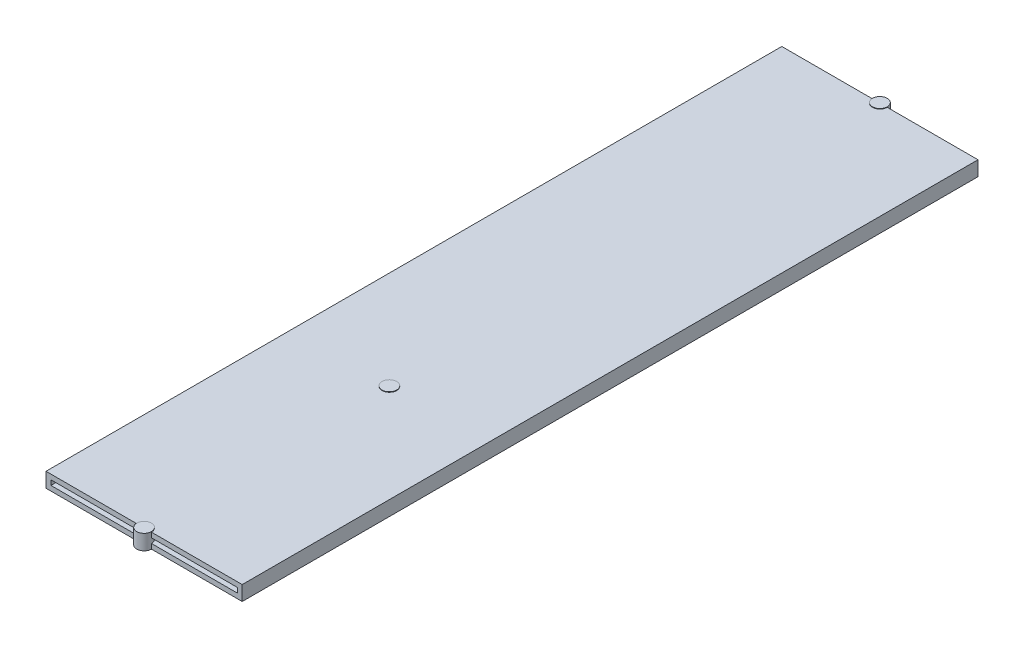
SolidWorks part; units mm, degrees
ref_plane "Plan de face" through (0, 0, 0) normal (0, 0, 1) x (1, 0, 0)
ref_plane "Plan de dessus" through (0, 0, 0) normal (0, 1, 0) x (1, 0, 0)
ref_plane "Plan de droite" through (0, 0, 0) normal (1, 0, 0) x (0, 0, -1)
sketch "Esquisse1" plane through (0, 0, 0) normal (0, 0, 1) x (1, 0, 0)
  line L0 (-190, 5) -> (190, 5)
  line L1 (-200, 15) -> (200, 15)
  line L2 (-200, 15) -> (-200, -15)
  line L3 (-200, -15) -> (200, -15)
  line L4 (200, 15) -> (200, -15)
  line L5 (-200, 15) -> (200, -15) construction
  line L6 (-200, -15) -> (200, 15) construction
  line L7 (190, 5) -> (190, -5)
  line L8 (-190, -5) -> (190, -5)
  line L9 (-190, 5) -> (-190, -5)
  point P0 (0, 0)
  dimension "D1" = 400
  dimension "D2" = 30
  dimension "D3" = 10
extrude "Boss.-Extru.1" add sketch "Esquisse1" along normal blind 500 and the other way blind 1000
sketch "Esquisse2" plane through (0, 0, 0) normal (0, 1, 0) x (1, 0, 0)
  line L0 (200, -500) -> (-200, -500) construction
  line L1 (200, 1000) -> (-200, 1000) construction
  line L2 (0, 1000) -> (0, -500) construction
  circle A0 centre (0, -500) radius 15
  circle A1 centre (0, 0) radius 15
  circle A2 centre (0, 1000) radius 15
  point P0 (0, 0)
  point P1 (0, -500)
  point P3 (0, 1000)
  point P14 (0, 0)
  point P15 (0, 0)
  point P16 (0, 0)
  point P17 (0, 0)
  point P18 (0, 0)
  dimension "D1" = 30
  dimension "D2" = 30
  dimension "D3" = 30
extrude "Boss.-Extru.2" add sketch "Esquisse2" along normal blind 16 and the other way blind 15 contours A0 | A1 | A2
